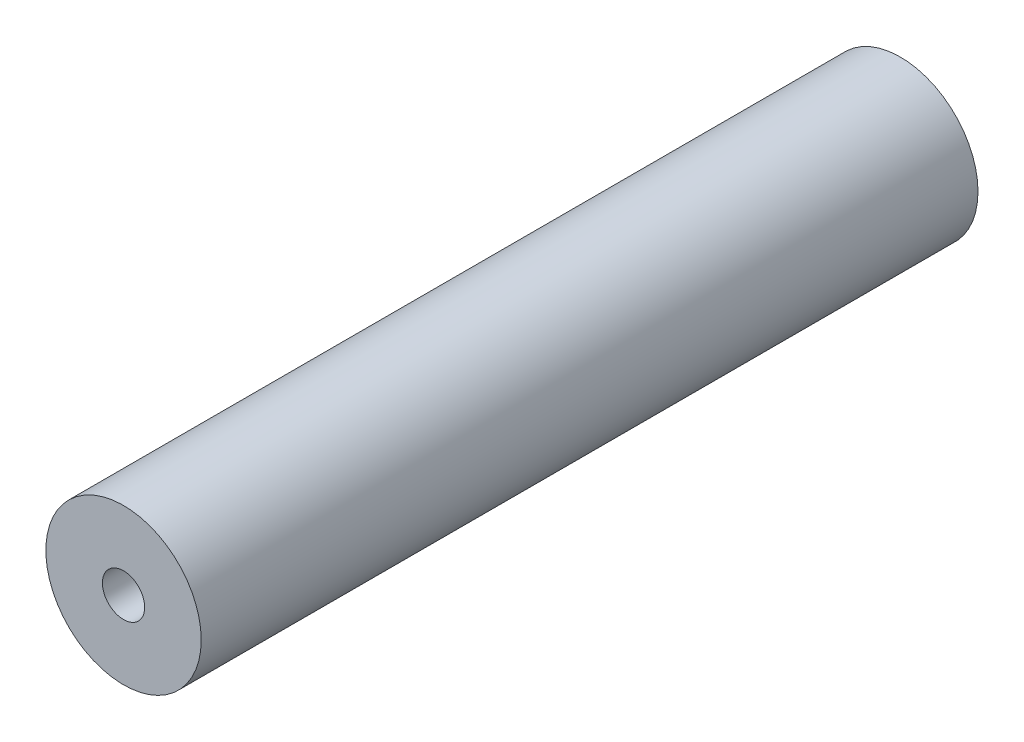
SolidWorks part; units mm, degrees
ref_plane "Plan de face" through (0, 0, 0) normal (0, 0, 1) x (1, 0, 0)
ref_plane "Plan de dessus" through (0, 0, 0) normal (0, 1, 0) x (1, 0, 0)
ref_plane "Plan de droite" through (0, 0, 0) normal (1, 0, 0) x (0, 0, -1)
sketch "Esquisse1" plane through (0, 0, 0) normal (0, 0, 1) x (1, 0, 0)
  circle A0 centre (0, 0) radius 12.5
  dimension "D1" = 25
extrude "Extrusion1" add sketch "Esquisse1" along normal mid plane 125
hole_wizard "Trou taraudé M81" positions "Esquisse3" profile "Esquisse2" tap size "M8" standard "ISO"
sketch "Esquisse3" plane through (0, 0, 62.5) normal (0, 0, 1) x (1, 0, 0)
  circle A0 centre (0, 0) radius 12.5 construction
  point P0 (0, 0)
sketch "Esquisse2" plane through (0, 0, 62.5) normal (1, 0, 0) x (0, -1, 0)
  line L0 (0, 0) -> (0, 24.2929)
  line L1 (0, 24.2929) -> (3.4, 22.25)
  line L2 (3.4, 22.25) -> (3.4, 0)
  line L5 (3.4, 0) -> (0, 0)
  line L10 (0, 24.2929) -> (-3.4, 22.25) construction
  line L11 (0, -6.35) -> (0, 107.95) construction
  dimension "Diamètre du trou pour taraudage" = 6.8
  dimension "Profondeur du trou pour taraudage" = 22.25
  dimension "Angle de pointe" = 118
hole_wizard "Trou taraudé M82" positions "Esquisse5" profile "Esquisse4" tap size "M8" standard "ISO"
sketch "Esquisse5" plane through (0, 0, -62.5) normal (0, 0, -1) x (-1, 0, 0)
  circle A0 centre (0, 0) radius 12.5 construction
  point P0 (0, 0)
sketch "Esquisse4" plane through (0, 0, -62.5) normal (1, 0, 0) x (0, 1, 0)
  line L0 (0, 0) -> (0, 24.2929)
  line L1 (0, 24.2929) -> (3.4, 22.25)
  line L2 (3.4, 22.25) -> (3.4, 0)
  line L5 (3.4, 0) -> (0, 0)
  line L10 (0, 24.2929) -> (-3.4, 22.25) construction
  line L11 (0, -6.35) -> (0, 107.95) construction
  dimension "Diamètre du trou pour taraudage" = 6.8
  dimension "Profondeur du trou pour taraudage" = 22.25
  dimension "Angle de pointe" = 118
